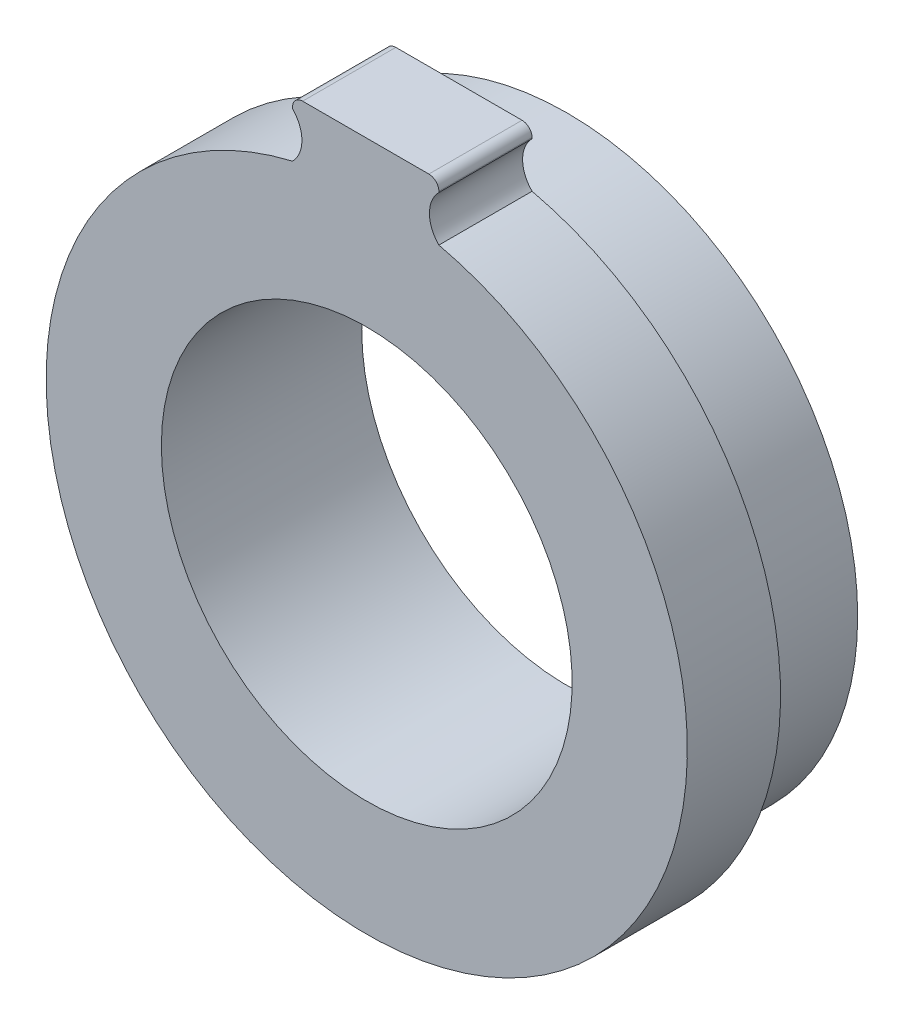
SolidWorks part; units mm, degrees
ref_plane "Plan de face" through (0, 0, 0) normal (0, 0, 1) x (1, 0, 0)
ref_plane "Plan de dessus" through (0, 0, 0) normal (0, 1, 0) x (1, 0, 0)
ref_plane "Plan de droite" through (0, 0, 0) normal (1, 0, 0) x (0, 0, -1)
sketch "Esquisse5" plane through (0, 0, -3.35) normal (0, 0, 1) x (1, 0, 0)
  circle A0 centre (0, 0) radius 16
extrude "Boss.-Extru.8" add sketch "Esquisse5" along normal blind 4.65 contours A0
sketch "Esquisse13" plane through (0, 0, -3.35) normal (0, 0, -1) x (-1, 0, 0)
  circle A0 centre (0, 0) radius 14.5
extrude "Boss.-Extru.9" add sketch "Esquisse13" along normal blind 5.35
sketch "Esquisse14" plane through (0, 0, -8.7) normal (0, 0, -1) x (-1, 0, 0)
  circle A0 centre (0, 0) radius 10.25
extrude "Enlèv. mat.-Extru.8" cut sketch "Esquisse14" against normal through all
sketch "Esquisse15" plane through (0, 0, 1.3) normal (0, 0, 1) x (1, 0, 0)
  line L1 (-3.7, 13.1) -> (3.6, 13.1)
  line L2 (-3.7, 13.1) -> (-3.7, 18.1929)
  line L3 (-2.9929, 18.9) -> (2.9929, 18.9)
  line L4 (3.6, 13.1) -> (3.6, 18.1929)
  line L5 (-3.7, 13.1) -> (0, 16) construction
  line L6 (0, 16) -> (3.6, 13.1) construction
  circle A0 centre (0, 0) radius 16 construction
  arc A1 (-3.7, 18.1929) -> (-2.9929, 18.9) centre (-2.9929, 18.1929) cw
  arc A2 (2.9929, 18.9) -> (3.6, 18.1929) centre (2.8929, 18.2) cw
  point P0 (0, 16)
  point P7 (-2.9432, 18.3709)
  point P8 (-2.9929, 18.1929)
  point P9 (2.8929, 18.2)
  dimension "D2" = 7.3
extrude "Boss.-Extru.10" add sketch "Esquisse15" against normal blind 4.65
sketch "Esquisse16" plane through (0, 0, 1.3) normal (0, 0, 1) x (1, 0, 0)
  line L0 (-3.7, 15.5663) -> (3.6, 15.5897) construction
  line L1 (3.6, 15.5897) -> (4.4066, 16.4016) construction
  line L2 (-3.7, 15.5663) -> (-4.4404, 16.3019) construction
  line L3 (-3.7, 15.5663) -> (-5.8428, 15.4514)
  line L4 (3.6, 15.5897) -> (5.8555, 15.5897)
  line L6 (-4.1712, 20.5692) -> (4.5282, 20.5692)
  line L7 (-4.1712, 20.5692) -> (-4.1712, 18.409)
  line L8 (-4.1712, 18.409) -> (4.5282, 18.409)
  line L9 (4.5282, 20.5692) -> (4.5282, 18.409)
  arc A0 (-3.7, 15.5663) -> (-5.8428, 15.4514) centre (-4.835, 16.694) ccw
  arc A1 (5.8555, 15.5897) -> (3.6, 15.5897) centre (4.7277, 16.7247) ccw
  point P4 (-4.835, 16.694)
  point P7 (4.7277, 16.7247)
  dimension "D1" = 135
  dimension "D2" = 135
  dimension "D3" = 1.6
  dimension "D4" = 1.6
extrude "Enlèv. mat.-Extru.9" cut sketch "Esquisse16" against normal blind 10
fillet "Congé3" radius 0.5 2 edges at (3.5684, 18.409, -1.025) (-3.6662, 18.409, -1.025)
